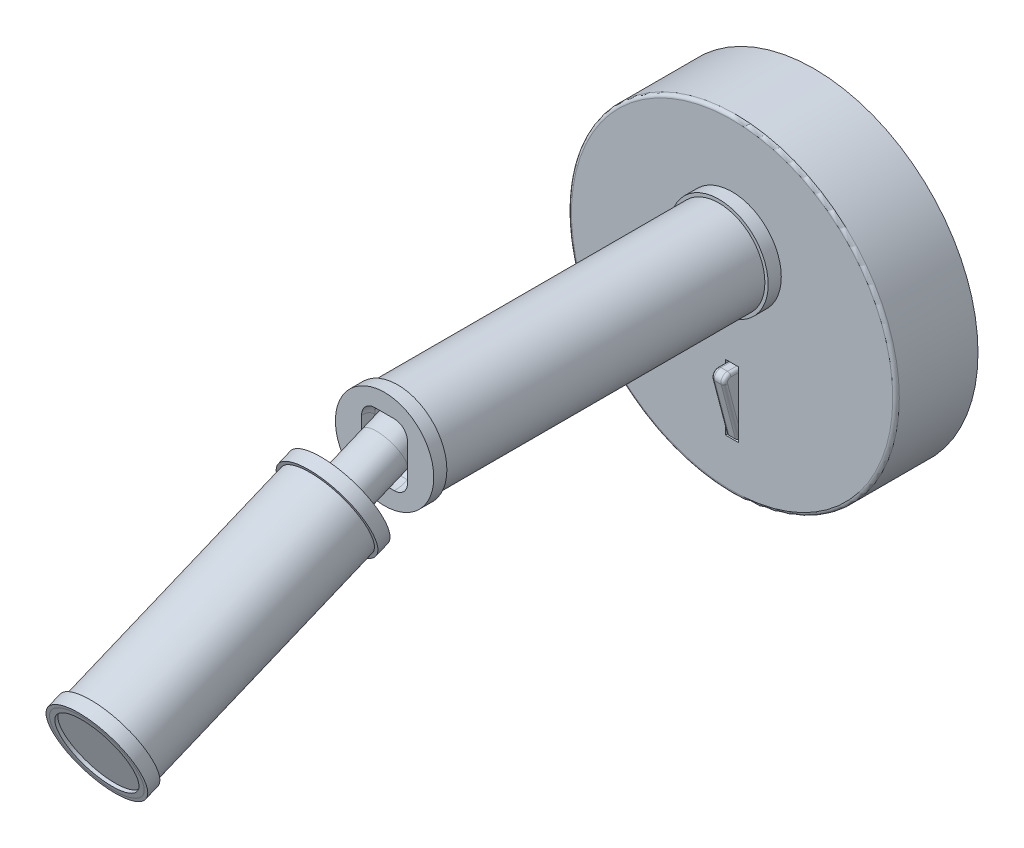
SolidWorks part; units mm, degrees
ref_plane "Alzado" through (0, 0, 0) normal (0, 0, 1) x (1, 0, 0)
ref_plane "Planta" through (0, 0, 0) normal (0, 1, 0) x (1, 0, 0)
ref_plane "Vista lateral" through (0, 0, 0) normal (1, 0, 0) x (0, 0, -1)
sketch "Croquis1" plane through (0, 0, 0) normal (0, 0, 1) x (1, 0, 0)
  circle A0 centre (0, 0) radius 50
  dimension "D1" = 100
extrude "Saliente-Extruir1" add sketch "Croquis1" along normal blind 25
sketch "Croquis2" plane through (0, 0, 25) normal (0, 0, 1) x (1, 0, 0)
  circle A0 centre (0, 15) radius 15
  dimension "D1" = 30
extrude "Saliente-Extruir2" add sketch "Croquis2" along normal blind 4 separate body
sketch "Croquis3" plane through (0, 0, 29) normal (0, 0, 1) x (1, 0, 0)
  circle A0 centre (0, 15) radius 14
  dimension "D1" = 28
extrude "Saliente-Extruir3" add sketch "Croquis3" along normal blind 98 separate body
sketch "Croquis4" plane through (0, 0, 127) normal (0, 0, 1) x (1, 0, 0)
  circle A0 centre (0, 15) radius 15
  dimension "D1" = 30
extrude "Saliente-Extruir4" add sketch "Croquis4" along normal blind 4 separate body
sketch "Croquis5" plane through (0, 0, 0) normal (1, 0, 0) x (0, 0, -1)
  line L0 (-131, 30) -> (-131, 0) construction
  circle A0 centre (-131, 15) radius 9.4888
extrude "Cortar-Extruir1" cut sketch "Croquis5" against normal mid plane 14
sketch "Croquis6" plane through (0, 0, 0) normal (1, 0, 0) x (0, 0, -1)
  line L0 (-131, 15) -> (-144.8558, 9.254)
  line L1 (-131, 30) -> (-131, 0) construction
  line L2 (-131, 15) -> (-117.5245, 20.5883)
  dimension "D1" = 15
sweep "Barrer1" add path "Croquis6" parameters "D3"=13
sketch "Croquis25" plane through (0, -49.899, 120.3249) normal (0, -0.3831, 0.9237) x (1, 0, 0)
  circle A0 centre (0, 64.0378) radius 13.5
  dimension "D1" = 27
extrude "Saliente-Extruir5" add sketch "Croquis25" along normal blind 80 separate body
sketch "Croquis26" plane through (0, -80.5445, 194.2225) normal (0, -0.3831, 0.9237) x (1, 0, 0)
  circle A0 centre (0, 64.0378) radius 12
  dimension "D1" = 24
extrude "Cortar-Extruir2" cut sketch "Croquis26" against normal blind 2
sketch "Croquis27" plane through (0, -79.7784, 192.3751) normal (0, -0.3831, 0.9237) x (1, 0, 0)
  circle A0 centre (0, 64.0378) radius 12
  dimension "D1" = 24
extrude "Saliente-Extruir6" add sketch "Croquis27" along normal blind 1 separate body
fillet "Redondeo1" radius 4 4 edges at (7, 24.2651, 128.9517) (7, 5.7349, 128.9517) (-7, 5.7349, 128.9517) (-7, 24.2651, 128.9517)
sketch "Croquis28" plane through (0, 0, 25) normal (0, 0, 1) x (1, 0, 0)
  line L0 (0, -50) -> (0, -25.2955) construction
  line L2 (-2, -15.2955) -> (2, -15.2955)
  line L3 (-2, -15.2955) -> (-2, -35.2955)
  line L4 (-2, -35.2955) -> (2, -35.2955)
  line L5 (2, -15.2955) -> (2, -35.2955)
  line L6 (-2, -15.2955) -> (2, -35.2955) construction
  line L7 (-2, -35.2955) -> (2, -15.2955) construction
  circle A0 centre (0, 0) radius 50 construction
  dimension "D1" = 20
  dimension "D2" = 4
extrude "Cortar-Extruir3" cut sketch "Croquis28" against normal blind 5
sketch "Croquis30" plane through (0, 0, 0) normal (1, 0, 0) x (0, 0, -1)
  line L0 (-20, -15.7429) -> (-30, -15.7429)
  line L1 (-20, -35.2955) -> (-20, -15.2955) construction
  line L2 (-30, -15.7429) -> (-25, -34.82)
  line L3 (-25, -35.2955) -> (-25, -15.2955) construction
  line L4 (-25, -34.82) -> (-20, -34.82)
  line L5 (-20, -34.82) -> (-20, -15.7429)
  dimension "D1" = 10
extrude "Saliente-Extruir7" add sketch "Croquis30" along normal mid plane 4 separate body
fillet "Redondeo2" radius 2 1 edges at (0, -15.7429, 30)
fillet "Redondeo3" radius 1 6 edges at (2, -15.7429, 23.7041) (2, -26.535, 27.1715) (-2, -15.7429, 23.7041) (-2, -16.521, 28.9916) (2, -16.521, 28.9916) (-2, -26.535, 27.1715)
fillet "Redondeo4" radius 1 1 edges at (50, 0, 25)
sketch "Croquis31" plane through (0, -80.5445, 194.2225) normal (0, -0.3831, 0.9237) x (1, 0, 0)
  circle A0 centre (0, 64.0378) radius 13.5
  circle A1 centre (0, 64.0378) radius 14.5
  dimension "D1" = 27
  dimension "D2" = 29
extrude "Saliente-Extruir8" add sketch "Croquis31" against normal blind 4 separate body
sketch "Croquis32" plane through (0, -49.899, 120.3249) normal (0, 0.3831, -0.9237) x (-1, 0, 0)
  circle A0 centre (0, 64.0378) radius 13.5
  circle A1 centre (0, 64.0378) radius 14.5
  dimension "D1" = 29
  dimension "D2" = 27
extrude "Saliente-Extruir9" add sketch "Croquis32" against normal blind 4 separate body
